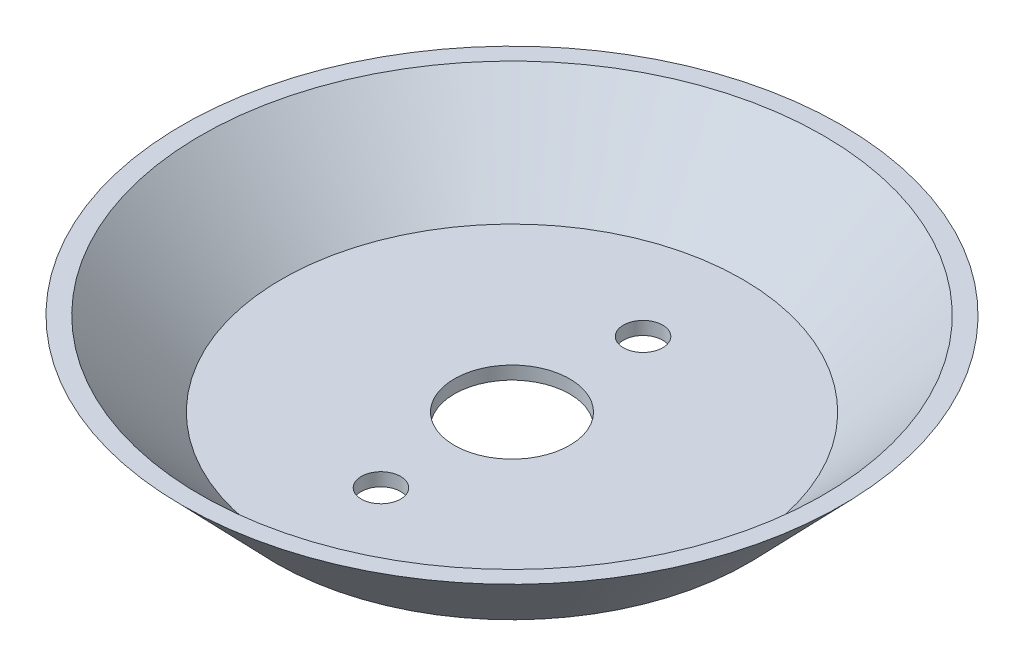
SolidWorks part; units mm, degrees
ref_plane "Plan de face" through (0, 0, 0) normal (0, 0, 1) x (1, 0, 0)
ref_plane "Plan de dessus" through (0, 0, 0) normal (0, 1, 0) x (1, 0, 0)
ref_plane "Plan de droite" through (0, 0, 0) normal (1, 0, 0) x (0, 0, -1)
sketch "Esquisse3" plane through (0, 0, 0) normal (0, 0, 1) x (1, 0, 0)
  line L0 (25.15, 7.4) -> (18, 0)
  line L1 (0, 0) -> (25.15, 0)
  line L2 (0, 0) -> (0, 7.4)
  line L3 (0, 7.4) -> (25.15, 7.4)
  line L4 (25.15, 0) -> (25.15, 7.4)
  line L5 (0, 38.8637) -> (0, -49.1745) construction
  point P5 (18, 0)
  dimension "D1" = 25.15
  dimension "D2" = 7.4
  dimension "D3" = 18
revolve "Révolution1" add sketch "Esquisse3" angle 360 about L5
shell "Coque4" thickness 1
sketch "Esquisse4" plane through (0, 1, 0) normal (0, 1, 0) x (-1, 0, 0)
  circle A0 centre (0, 0) radius 4.4
  dimension "D1" = 8.8
extrude "Enlèv. mat.-Extru.2" cut sketch "Esquisse4" against normal blind 7.14
sketch "Esquisse5" plane through (0, 1, 0) normal (0, 1, 0) x (-1, 0, 0)
  line L0 (0, 17.5757) -> (0, -17.5757) construction
  line L1 (17.5757, 0) -> (-17.5757, 0) construction
  circle A0 centre (0, 0) radius 17.5757 construction
  circle A1 centre (0, -10) radius 1.5
  circle A2 centre (0, 10) radius 1.5
  dimension "D1" = 3
  dimension "D2" = 10
extrude "Enlèv. mat.-Extru.3" cut sketch "Esquisse5" against normal blind 10
